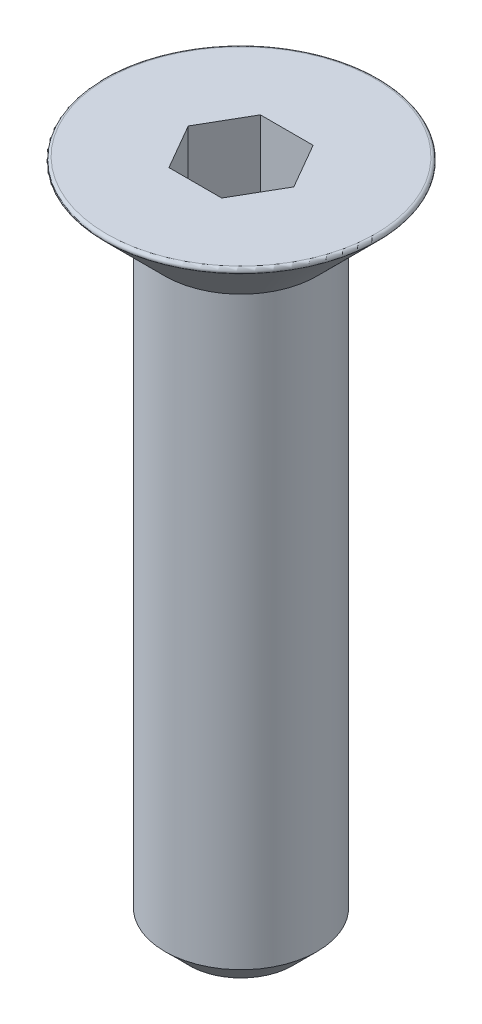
SolidWorks part; units mm, degrees
ref_plane "Plan de face" through (0, 0, 0) normal (0, 0, 1) x (1, 0, 0)
ref_plane "Plan de dessus" through (0, 0, 0) normal (0, 1, 0) x (1, 0, 0)
ref_plane "Plan de droite" through (0, 0, 0) normal (1, 0, 0) x (0, 0, -1)
sketch "Esquisse1" plane through (0, 0, 0) normal (0, 0, 1) x (1, 0, 0)
  line L0 (0, 15.488) -> (0, -29.9279) construction
  line L1 (0, 0) -> (-4.65, 0)
  line L2 (-4.65, 0) -> (-2.5, -2.15)
  line L3 (-2.5, -2.15) -> (-2.5, -22.15)
  line L4 (-2.5, -22.15) -> (0, -22.15)
  line L5 (0, 0) -> (0, -22.15)
  dimension "D1" = 4.65
  dimension "D2" = 2.5
  dimension "D3" = 45
  dimension "D4" = 20
revolve "Révolution1" add sketch "Esquisse1" angle 360 about L0
fillet "Congé1" radius 0.1 1 edges at (0, 0, 4.65)
chamfer "Chanfrein1" distance 0.8 angle 45 1 edges at (0, -22.15, 2.5)
sketch "Esquisse2" plane through (0, 0, 0) normal (0, 1, 0) x (1, 0, 0)
  line L1 (1.7321, 0) -> (0.866, 1.5)
  line L2 (0.866, 1.5) -> (-0.866, 1.5)
  line L3 (-0.866, 1.5) -> (-1.7321, 0)
  line L4 (-1.7321, 0) -> (-0.866, -1.5)
  line L5 (-0.866, -1.5) -> (0.866, -1.5)
  line L6 (0.866, -1.5) -> (1.7321, 0)
  circle A0 centre (0, 0) radius 1.5 construction
  dimension "D1" = 3
extrude "Enlèv. mat.-Extru.1" cut sketch "Esquisse2" against normal blind 3
